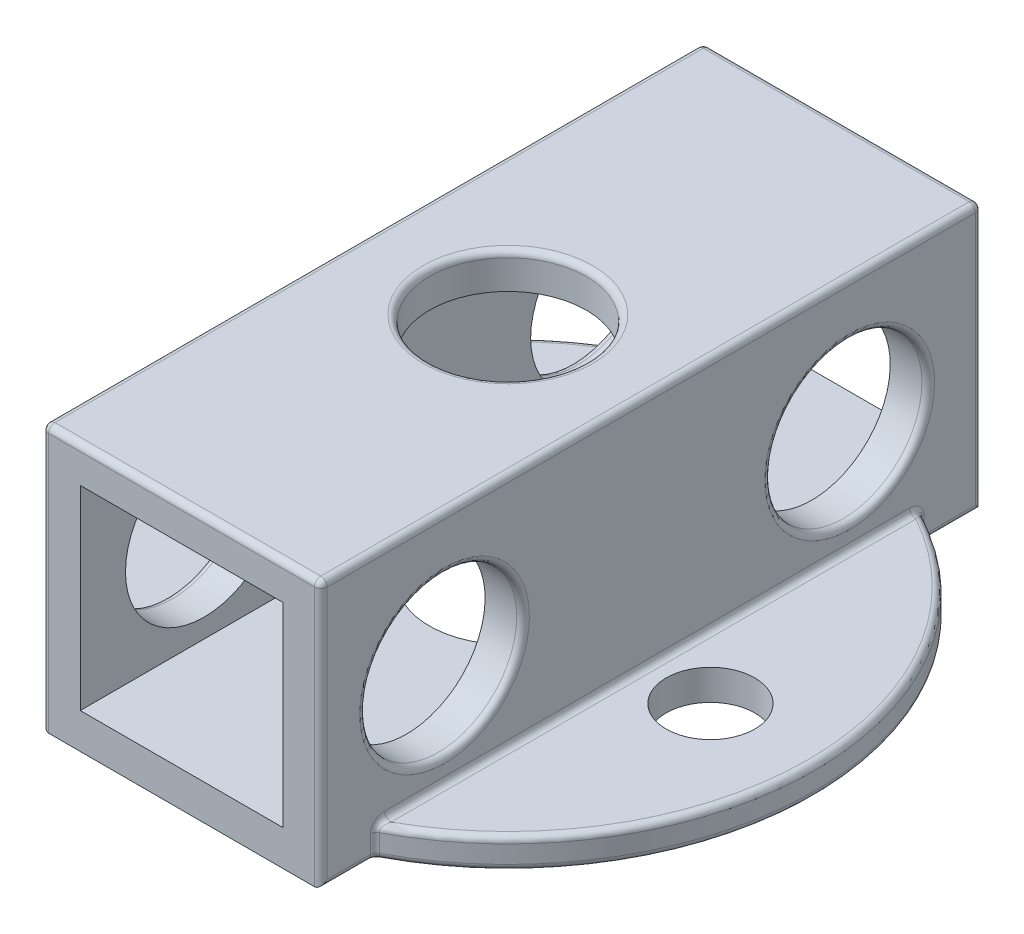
SolidWorks part; units mm, degrees
ref_plane "Front Plane" through (0, 0, 0) normal (0, 0, 1) x (1, 0, 0)
ref_plane "Top Plane" through (0, 0, 0) normal (0, 1, 0) x (1, 0, 0)
ref_plane "Right Plane" through (0, 0, 0) normal (1, 0, 0) x (0, 0, -1)
sketch "Sketch1" plane through (0, 0, 0) normal (0, 1, 0) x (1, 0, 0)
  circle A0 centre (0, 0) radius 12.1
  dimension "D1" = 24.2
extrude "Extrude1" add sketch "Sketch1" along normal blind 1.2
sketch "Sketch2" plane through (0, 0, 0) normal (0, -1, 0) x (1, 0, 0)
  circle A0 centre (8, 0) radius 1.75
  circle A1 centre (-8, 0) radius 1.75
  dimension "D1" = 3.5
  dimension "D2" = 3.5
  dimension "D3" = 8
  dimension "D4" = 8
extrude "Cut-Extrude1" cut sketch "Sketch2" against normal through all
sketch "Sketch4" plane through (0, 0, 0) normal (0, -1, 0) x (1, 0, 0)
  line L1 (-5.5, 12.8852) -> (5.5, 12.8852)
  line L2 (-5.5, 12.8852) -> (-5.5, -13.2114)
  line L3 (-5.5, -13.2114) -> (5.5, -13.2114)
  line L4 (5.5, 12.8852) -> (5.5, -13.2114)
  dimension "D1" = 11
  dimension "D2" = 5.5
extrude "Extrude2" add sketch "Sketch4" against normal blind 10.5
sketch "Sketch5" plane through (0, 0, 12.8852) normal (0, 0, 1) x (1, 0, 0)
  line L1 (-4, 9.1) -> (4, 9.1)
  line L2 (-4, 9.1) -> (-4, 1.4)
  line L3 (-4, 1.4) -> (4, 1.4)
  line L4 (4, 9.1) -> (4, 1.4)
  line L5 (5.5, 10.5) -> (-5.5, 10.5) construction
  dimension "D1" = 8
  dimension "D2" = 7.7
  dimension "D3" = 4
  dimension "D4" = 1.4
extrude "Cut-Extrude2" cut sketch "Sketch5" against normal through all
sketch "Sketch6" plane through (0, 0, 0) normal (0, -1, 0) x (1, 0, 0)
  circle A0 centre (0, 0) radius 3.1
  dimension "D1" = 6.2
extrude "Cut-Extrude3" cut sketch "Sketch6" against normal through all
sketch "Sketch7" plane through (-5.5, 0, 0) normal (-1, 0, 0) x (0, 0, 1)
  circle A0 centre (8, 5.25) radius 3.1
  circle A1 centre (-8, 5.25) radius 3.1
  dimension "D1" = 6.2
  dimension "D2" = 6.2
  dimension "D3" = 8
  dimension "D4" = 8
  dimension "D5" = 5.25
  dimension "D6" = 5.25
extrude "Cut-Extrude4" cut sketch "Sketch7" against normal through all
sketch "Sketch8" plane through (0, 0, 0) normal (0, -1, 0) x (1, 0, 0)
  circle A0 centre (0, 8.3046) radius 2.5
  circle A1 centre (0, -6.5704) radius 2.5
  dimension "D1" = 5
  dimension "D2" = 5
extrude "Cut-Extrude5" cut sketch "Sketch8" against normal blind 0.25
sketch "Sketch10" plane through (0, 0.25, 0) normal (0, -1, 0) x (1, 0, 0)
  circle A0 centre (0, 8.3046) radius 1.6
  circle A1 centre (0, -6.5704) radius 1.6
  dimension "D1" = 3.2
  dimension "D2" = 3.2
extrude "Extrude3" add sketch "Sketch10" along normal blind 1
fillet "Fillet1" radius 0.25 13 edges at (5.5, 0, -11.9946) (5.5, 0, 11.8315) (5.5, 1.2, 0) (5.5, 0.6, 10.7778) (5.5, 0.6, -10.7778) (12.1, 0, 0) (12.1, 1.2, 0) (5.5, 5.25, 12.8852) (5.5, 5.25, -13.2114) (0, 10.5, -13.2114) (-5.5, 10.5, -0.1631) (0, 10.5, 12.8852) (5.5, 10.5, -0.1631)
fillet "Fillet2" radius 0.25 16 edges at (-5.4268, 10.4268, -13.1382) (-5.4268, 10.4268, 12.812) (5.5, 5.25, -11.1) (5.5, 5.25, 4.9) (0, 10.5, -3.1) (-5.5, 0, 11.8315) (-5.5, 1.2, 0) (-5.5, 0, -11.9946) (-5.5, 5.125, -13.2114) (-5.5, 5.125, 12.8852) (-5.5, 5.25, 11.1) (-5.5, 5.25, -4.9) (-5.5, 0.6, -10.7778) (-5.5, 0.6, 10.7778) (-12.1, 0, 0) (-12.1, 1.2, 0)
